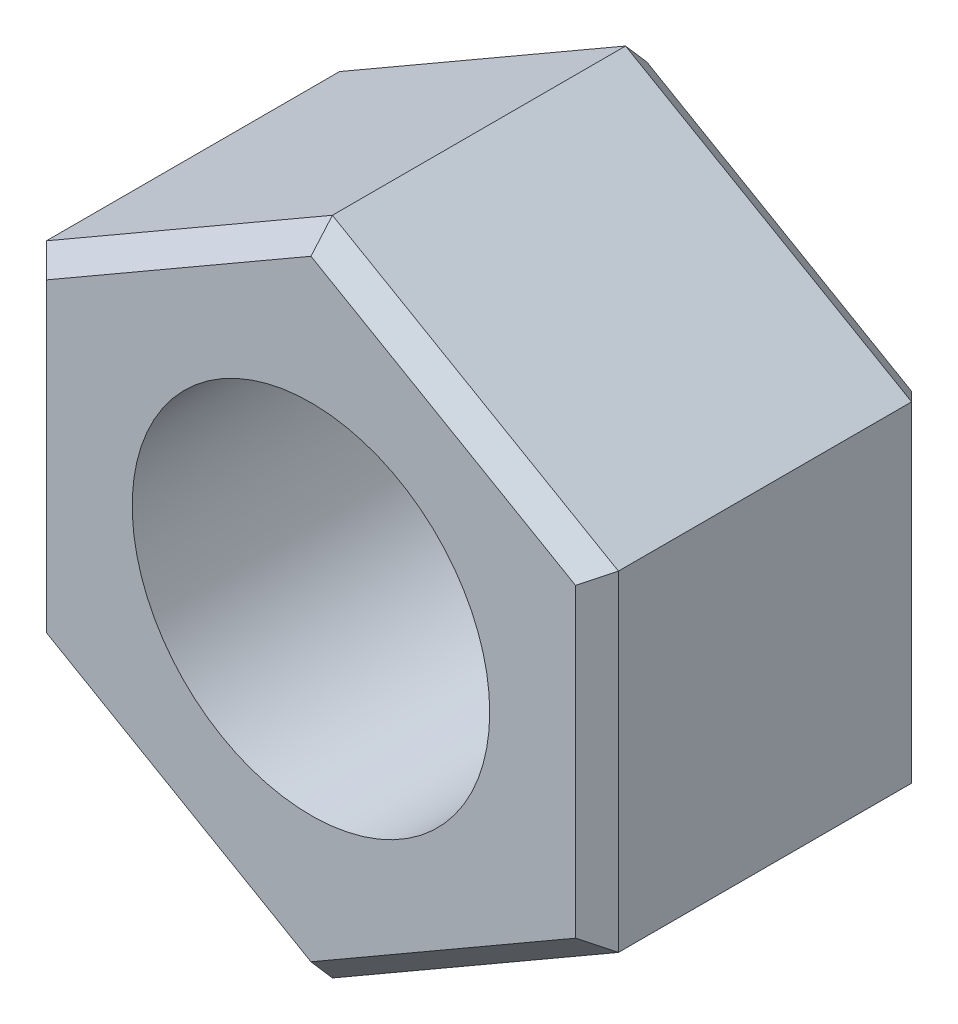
SolidWorks part; units mm, degrees
ref_plane "Plan1" through (0, 0, 0) normal (0, 0, 1) x (1, 0, 0)
ref_plane "Plan2" through (0, 0, 0) normal (0, 1, 0) x (1, 0, 0)
ref_plane "Plan3" through (0, 0, 0) normal (1, 0, 0) x (0, 0, -1)
sketch "Esquisse1" plane through (0, 0, 0) normal (0, 0, 1) x (1, 0, 0)
  line L1 (0, 4.6188) -> (-4, 2.3094)
  line L2 (-4, 2.3094) -> (-4, -2.3094)
  line L3 (-4, -2.3094) -> (0, -4.6188)
  line L4 (0, -4.6188) -> (4, -2.3094)
  line L5 (4, -2.3094) -> (4, 2.3094)
  line L6 (4, 2.3094) -> (0, 4.6188)
  circle A0 centre (0, 0) radius 4 construction
  dimension "D1" = 8
extrude "Base-Extrusion" add sketch "Esquisse1" along normal blind 4.7
sketch "Esquisse2" plane through (0, 0, 4.7) normal (0, 0, 1) x (1, 0, 0)
  circle A0 centre (0, 0) radius 2.5
  dimension "D1" = 5
extrude "Enlèv. mat.-Extru.1" cut sketch "Esquisse2" against normal blind 4.7
chamfer "Chanfrein2" distance 0.3 angle 45
chamfer "Chanfrein3" distance 0.3 angle 45
